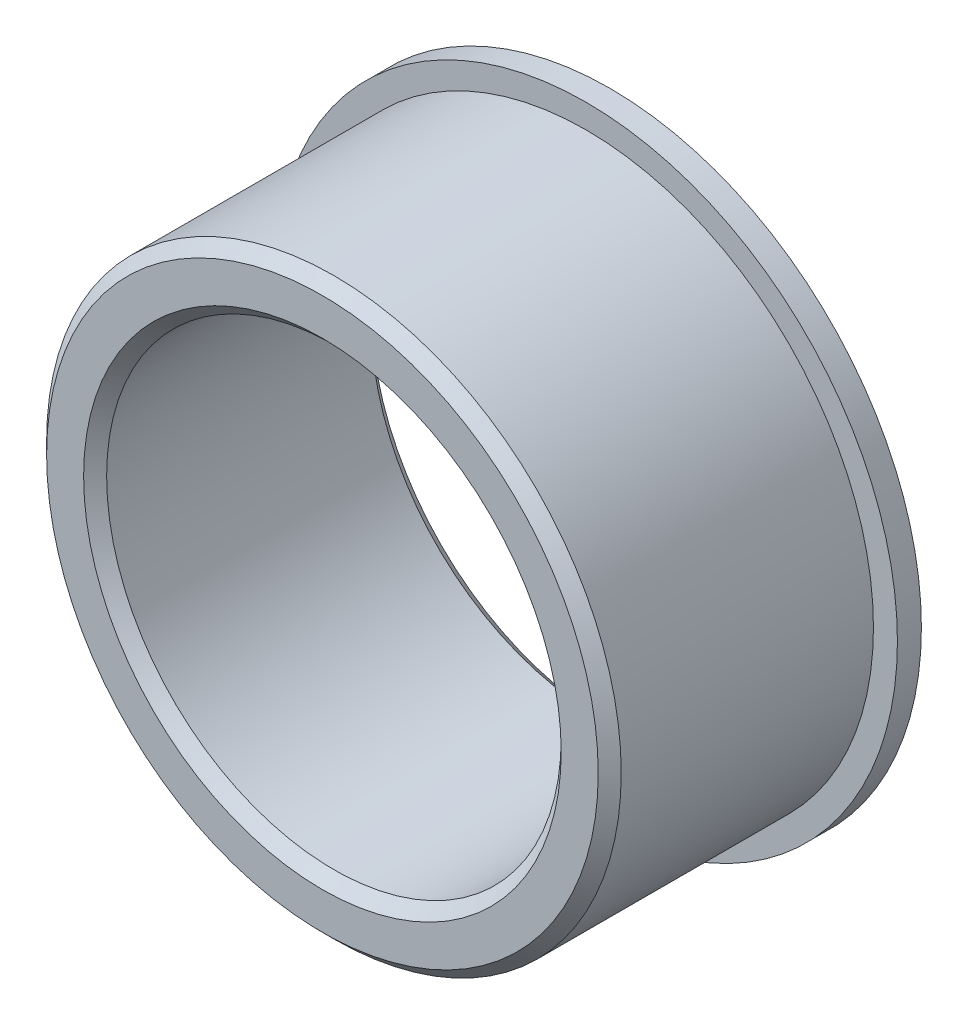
SolidWorks part; units mm, degrees
ref_plane "Front Plane" through (0, 0, 0) normal (0, 0, 1) x (1, 0, 0)
ref_plane "Top Plane" through (0, 0, 0) normal (0, 1, 0) x (1, 0, 0)
ref_plane "Right Plane" through (0, 0, 0) normal (1, 0, 0) x (0, 0, -1)
sketch "Sketch1" plane through (0, 0, 0) normal (1, 0, 0) x (0, 0, -1)
  line L0 (0, 0) -> (19.05, 0) construction
  line L1 (19.05, 0) -> (19.05, 20.6125) construction
  line L2 (19.05, 20.6125) -> (17.4625, 20.6125)
  line L3 (17.4625, 20.6125) -> (17.4625, 19.025)
  line L4 (17.4625, 19.025) -> (0, 19.025)
  line L5 (0, 19.025) -> (0, 15.05)
  line L6 (0, 15.05) -> (19.05, 15.05)
  line L7 (19.05, 20.6125) -> (19.05, 15.05)
  dimension "D1" = 38.05
  dimension "D2" = 30.1
  dimension "D3" = 19.05
  dimension "D4" = 1.5875
  dimension "D5" = 1.5875
  dimension "D6" = 30.1
revolve "Revolve1" add sketch "Sketch1" angle 360 about L0
chamfer "Chamfer1" distance 0.762 angle 45 3 edges at (15.05, 0, -19.05) (15.05, 0, 0) (19.025, 0, 0)
